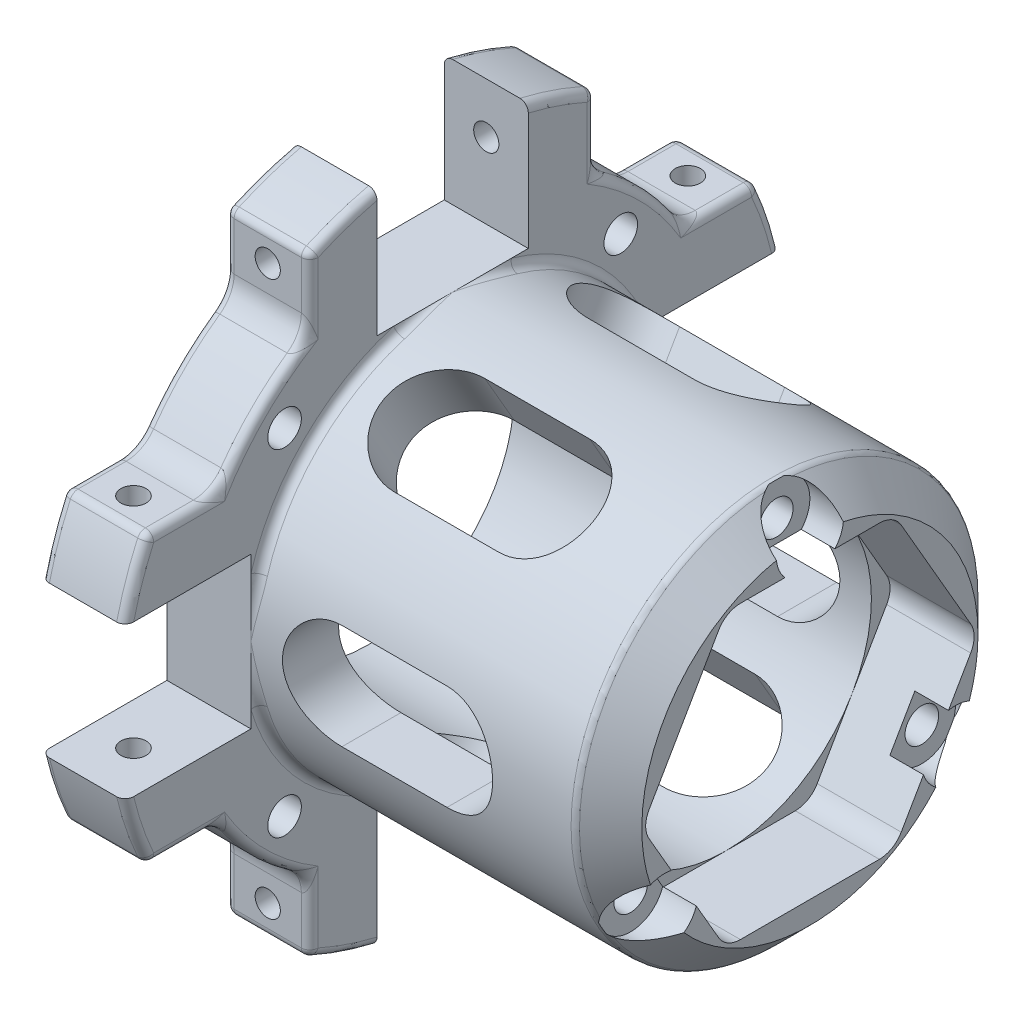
SolidWorks part; units mm, degrees
ref_plane "Front Plane" through (0, 0, 0) normal (0, 0, 1) x (1, 0, 0)
ref_plane "Top Plane" through (0, 0, 0) normal (0, 1, 0) x (1, 0, 0)
ref_plane "Right Plane" through (0, 0, 0) normal (1, 0, 0) x (0, 0, -1)
sketch "Sketch2" plane through (0, 0, 0) normal (0, 0, 1) x (1, 0, 0)
  line L0 (0, 0) -> (124.7538, 0) construction
  line L1 (0, 0) -> (0, 50.8)
  line L2 (0, 50.8) -> (12.7, 50.8)
  line L3 (12.7, 50.8) -> (12.7, 30.48)
  line L4 (12.7, 30.48) -> (66.675, 30.48)
  line L5 (66.675, 30.48) -> (66.675, 0)
  line L6 (66.675, 0) -> (0, 0)
  dimension "D1" = 30.48
  dimension "D2" = 53.975
  dimension "D3" = 12.7
  dimension "D4" = 50.8
revolve "Revolve1" add sketch "Sketch2" angle 360 about L0
chamfer "Chamfer1" distance 5.08 angle 45 1 edges at (66.675, 0, 30.48)
sketch "Sketch4" plane through (66.675, 0, 0) normal (1, 0, 0) x (0, 0, -1)
  line L1 (-12.7, 21.997) -> (-25.4, 0)
  line L2 (-25.4, 0) -> (-12.7, -21.997)
  line L3 (-12.7, -21.997) -> (12.7, -21.997)
  line L4 (12.7, -21.997) -> (25.4, 0)
  line L5 (25.4, 0) -> (12.7, 21.997)
  line L6 (12.7, 21.997) -> (-12.7, 21.997)
  circle A0 centre (0, 0) radius 21.997 construction
  dimension "D1" = 50.8
extrude "Cut-Extrude2" cut sketch "Sketch4" against normal blind 12.7
sketch "Sketch6" plane through (0, 0, 0) normal (-1, 0, 0) x (0, 0, 1)
  circle A0 centre (0, 0) radius 21.997
  dimension "D1" = 43.9941
extrude "Cut-Extrude4" cut sketch "Sketch6" against normal blind 53.975
sketch "Sketch7" plane through (12.7, 0, 0) normal (1, 0, 0) x (0, 0, -1)
  line L0 (0, 0) -> (0, 67.5131) construction
  line L1 (-11.43, 55.88) -> (11.43, 55.88)
  line L2 (-11.43, 55.88) -> (-11.43, 30.48)
  line L3 (-11.43, 30.48) -> (11.43, 30.48)
  line L4 (11.43, 55.88) -> (11.43, 30.48)
  circle A0 centre (0, 0) radius 30.48 construction
  dimension "D1" = 25.4
  dimension "D2" = 22.86
  dimension "D3" = 11.43
extrude "Cut-Extrude5" cut sketch "Sketch7" against normal through all
pattern_circular "CirPattern3" count 4 over 360 about axis through (0, 0, 0) along (1, 0, 0) of "Cut-Extrude5"
sketch "Sketch8" plane through (12.7, 0, 0) normal (1, 0, 0) x (0, 0, -1)
  line L0 (-45.9838, 21.59) -> (-35.1781, 21.59)
  line L1 (-21.59, 35.1781) -> (-21.59, 45.9838)
  line L3 (-30.48, 11.43) -> (-49.4974, 11.43) construction
  line L4 (-11.43, 49.4974) -> (-11.43, 30.48) construction
  arc A0 (-21.59, 35.1781) -> (-35.1781, 21.59) centre (0, 0) ccw
  arc A2 (-21.59, 45.9838) -> (-45.9838, 21.59) centre (0, 0) ccw
  dimension "D1" = 82.55
  dimension "D2" = 50.8
  dimension "D3" = 10.16
  dimension "D4" = 10.16
extrude "Cut-Extrude6" cut sketch "Sketch8" against normal through all
pattern_circular "CirPattern4" count 4 over 360 about axis through (0, 0, 0) along (1, 0, 0) of "Cut-Extrude6"
fillet "Fillet1" radius 1.27 20 edges at (12.7, -16.6032, 48.0101) (12.7, -21.59, 40.581) (12.7, -29.1858, 29.1858) (12.7, -40.581, 21.59) (12.7, -48.0101, 16.6032) (12.7, -48.0101, -16.6032) (12.7, -40.581, -21.59) (12.7, -29.1858, -29.1858) (12.7, -21.59, -40.581) (12.7, -16.6032, -48.0101) (12.7, 16.6032, -48.0101) (12.7, 21.59, -40.581) (12.7, 29.1858, -29.1858) (12.7, 40.581, -21.59) (12.7, 48.0101, -16.6032) (12.7, 16.6032, 48.0101) (12.7, 48.0101, 16.6032) (12.7, 40.581, 21.59) (12.7, 29.1858, 29.1858) (12.7, 21.59, 40.581)
fillet "Fillet2" radius 5.08 16 edges at (12.1478, 21.3677, 35.0535) (12.1478, 35.0535, 21.3677) (12.1478, 35.0535, -21.3677) (12.1478, 21.3677, -35.0535) (12.1478, -21.3677, -35.0535) (12.1478, -35.0535, -21.3677) (12.1478, -35.0535, 21.3677) (12.1478, -21.3677, 35.0535) (5.715, 21.59, 35.1781) (5.715, 35.1781, 21.59) (5.715, 35.1781, -21.59) (5.715, 21.59, -35.1781) (5.715, -21.59, -35.1781) (5.715, -35.1781, -21.59) (5.715, -35.1781, 21.59) (5.715, -21.59, 35.1781)
fillet "Fillet3" radius 1.27 16 edges at (12.1312, -21.3789, -45.8495) (12.1312, -45.8495, -21.3789) (12.1312, -45.8495, 21.3789) (12.1312, -21.3789, 45.8495) (12.1312, 21.3789, 45.8495) (12.1312, 45.8495, 21.3789) (12.1312, 45.8495, -21.3789) (12.1312, 21.3789, -45.8495) (5.715, -21.59, -45.9838) (5.715, -45.9838, -21.59) (5.715, -45.9838, 21.59) (5.715, -21.59, 45.9838) (5.715, 21.59, 45.9838) (5.715, 45.9838, 21.59) (5.715, 45.9838, -21.59) (5.715, 21.59, -45.9838)
fillet "Fillet4" radius 1.27 36 edges at (0, 48.1433, -16.2131) (0, 45.8595, -21.3864) (0, 16.2131, -48.1433) (0, 21.3864, -45.8595) (0, 21.59, -41.5421) (0, 22.1615, -35.5735) (0, 29.1858, -29.1858) (0, 35.5735, -22.1615) (0, -16.2131, -48.1433) (0, -21.3864, -45.8595) (0, -21.59, -41.5421) (0, -22.1615, -35.5735) (0, -29.1858, -29.1858) (0, -35.5735, -22.1615) (0, -48.1433, -16.2131) (0, -45.8595, -21.3864) (0, -48.1433, 16.2131) (0, -45.8595, 21.3864) (0, -41.5421, 21.59) (0, -35.5735, 22.1615) (0, -29.1858, 29.1858) (0, -22.1615, 35.5735) (0, -16.2131, 48.1433) (0, -21.3864, 45.8595) (0, 16.2131, 48.1433) (0, 21.3864, 45.8595) (0, 21.59, 41.5421) (0, 22.1615, 35.5735) (0, 29.1858, 29.1858) (0, 35.5735, 22.1615) (0, 41.5421, 21.59) (0, 45.8595, 21.3864) (0, 41.5421, -21.59) (0, -41.5421, -21.59) (0, -21.59, 41.5421) (0, 48.1433, 16.2131)
fillet "Fillet5" radius 1.27 4 edges at (12.7, 21.5526, -21.5526) (12.7, 21.5526, 21.5526) (12.7, -21.5526, 21.5526) (12.7, -21.5526, -21.5526)
fillet "Fillet6" radius 1.27 1 edges at (61.595, 0, 30.48)
sketch "Sketch9" plane through (0, 11.43, 0) normal (0, -1, 0) x (1, 0, 0)
  line L0 (11.43, -49.4974) -> (1.27, -49.4974) construction
  line L1 (0, -48.1931) -> (0, -30.48) construction
  circle A0 centre (6.35, -41.8774) radius 1.905
  point P2 (6.35, -49.4974)
  dimension "D1" = 3.81
  dimension "D2" = 7.62
  dimension "D3" = 6.35
extrude "Cut-Extrude7" cut sketch "Sketch9" against normal mid plane 76.2
pattern_circular "CirPattern5" count 4 over 360 about axis through (66.675, 0, 0) along (-1, 0, 0) of "Cut-Extrude7"
fillet "Fillet7" radius 3.81 6 edges at (60.325, -21.997, 12.7) (60.325, 0, -25.4) (60.325, -21.997, -12.7) (60.325, 21.997, -12.7) (60.325, 21.997, 12.7) (60.325, 0, 25.4)
sketch "Sketch11" plane through (12.7, 0, 0) normal (1, 0, 0) x (0, 0, -1)
  circle A0 centre (25.4, 25.4) radius 2.54
  dimension "D1" = 5.08
  dimension "D2" = 25.4
  dimension "D3" = 25.4
extrude "Cut-Extrude8" cut sketch "Sketch11" against normal blind 12.7
pattern_circular "CirPattern6" count 4 over 360 about axis through (0, 0, 0) along (1, 0, 0) of "Cut-Extrude8"
sketch "Sketch12" plane through (66.675, 0, 0) normal (1, 0, 0) x (0, 0, -1)
  circle A0 centre (0, 25.4) radius 5.08
  dimension "D1" = 10.16
  dimension "D2" = 25.4
extrude "Cut-Extrude9" cut sketch "Sketch12" against normal blind 5.08
pattern_circular "CirPattern7" count 3 over 360 about axis through (0, 0, 0) along (1, 0, 0) of "Cut-Extrude9"
sketch "Sketch13" plane through (61.595, 0, 0) normal (1, 0, 0) x (0, 0, -1)
  circle A0 centre (0, 25.4) radius 2.54
  dimension "D1" = 5.08
  dimension "D2" = 25.4
extrude "Cut-Extrude10" cut sketch "Sketch13" against normal blind 12.7
pattern_circular "CirPattern8" count 3 over 360 about axis through (0, 0, 0) along (1, 0, 0) of "Cut-Extrude10"
sketch "Sketch14" plane through (0, 0, 0) normal (0, 0, 1) x (1, 0, 0)
  line L0 (25.4, 0) -> (41.275, 0) construction
  line L1 (25.4, 7.9375) -> (41.275, 7.9375)
  line L2 (25.4, -7.9375) -> (41.275, -7.9375)
  line L3 (0, -11.43) -> (0, 11.43) construction
  line L4 (66.675, -8.0686) -> (66.675, 0) construction
  arc A0 (25.4, 7.9375) -> (25.4, -7.9375) centre (25.4, 0) ccw
  arc A1 (41.275, -7.9375) -> (41.275, 7.9375) centre (41.275, 0) ccw
  point P3 (33.3375, 0)
  dimension "D1" = 25.4
  dimension "D2" = 25.4
  dimension "D3" = 15.875
extrude "Cut-Extrude11" cut sketch "Sketch14" against normal through all
pattern_circular "CirPattern9" count 6 over 360 about axis through (0, 0, 0) along (1, 0, 0) of "Cut-Extrude11"
